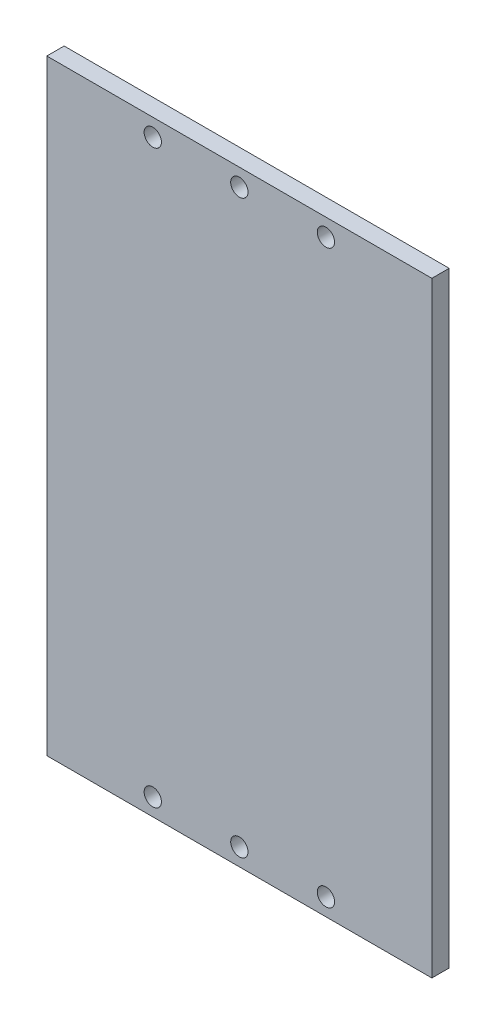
SolidWorks part; units mm, degrees
ref_plane "Front Plane" through (0, 0, 0) normal (0, 0, 1) x (1, 0, 0)
ref_plane "Top Plane" through (0, 0, 0) normal (0, 1, 0) x (1, 0, 0)
ref_plane "Right Plane" through (0, 0, 0) normal (1, 0, 0) x (0, 0, -1)
sketch "Sketch1" plane through (0, 0, 0) normal (0, 0, 1) x (1, 0, 0)
  line L0 (-24.9424, 1) -> (-9.2711, 1)
  line L5 (13.97, 5) -> (13.97, -35) construction
  line L7 (-30.5122, -1) -> (13.97, -1)
  line L8 (-7.2711, 1) -> (8.4003, 1)
  line L9 (-24.9424, -3) -> (-9.2711, -3)
  line L10 (-7.2711, -3) -> (8.4003, -3)
  line L11 (-24.9424, -7) -> (-9.2711, -7)
  line L12 (-7.2711, -7) -> (8.4003, -7)
  line L13 (-24.9424, -11) -> (-9.2711, -11)
  line L14 (-7.2711, -11) -> (8.4003, -11)
  line L15 (-24.9424, -15) -> (-9.2711, -15)
  line L16 (-7.2711, -15) -> (8.4003, -15)
  line L17 (-24.9424, -19) -> (-9.2711, -19)
  line L18 (-7.2711, -19) -> (8.4003, -19)
  line L19 (-24.9424, -23) -> (-9.2711, -23)
  line L20 (-7.2711, -23) -> (8.4003, -23)
  line L21 (-24.9424, -27) -> (-9.2711, -27)
  line L22 (-7.2711, -27) -> (8.4003, -27)
  line L23 (-24.9424, -31) -> (-9.2711, -31)
  line L24 (-7.2711, -31) -> (8.4003, -31)
  line L25 (-24.9424, -35) -> (-9.2711, -35)
  line L26 (-7.2711, -35) -> (8.4003, -35)
  line L27 (-24.9424, -39) -> (-9.2711, -39)
  line L28 (-7.2711, -39) -> (8.4003, -39)
  line L29 (-24.9424, -43) -> (-9.2711, -43)
  line L30 (-7.2711, -43) -> (8.4003, -43)
  line L31 (-24.9424, -47) -> (-9.2711, -47)
  line L32 (-7.2711, -47) -> (8.4003, -47)
  line L33 (-24.9424, -51) -> (-9.2711, -51)
  line L34 (-7.2711, -51) -> (8.4003, -51)
  line L35 (-24.9424, -55) -> (-9.2711, -55)
  line L36 (-7.2711, -55) -> (8.4003, -55)
  line L37 (-30.5122, -5) -> (13.97, -5)
  line L38 (-30.5122, -9) -> (13.97, -9)
  line L39 (-30.5122, -13) -> (13.97, -13)
  line L40 (-30.5122, -17) -> (13.97, -17)
  line L41 (-30.5122, -21) -> (13.97, -21)
  line L42 (-30.5122, -25) -> (13.97, -25)
  line L43 (-30.5122, -29) -> (13.97, -29)
  line L44 (-24.9424, -59) -> (-9.2711, -59)
  line L45 (-7.2711, -59) -> (8.4003, -59)
  line L46 (-30.5122, -33) -> (13.97, -33)
  line L47 (-30.5122, -37) -> (13.97, -37)
  line L48 (-30.5122, -41) -> (13.97, -41)
  line L49 (-30.5122, -45) -> (13.97, -45)
  line L50 (-30.5122, -49) -> (13.97, -49)
  line L51 (-30.5122, -53) -> (13.97, -53)
  line L52 (-30.5122, -57) -> (13.97, -57)
  point P0 (0, 0)
  point P1 (0, 0)
  point P2 (0, 0)
sketch "Croquis1" plane through (0, 0, 0) normal (0, 0, 1) x (1, 0, 0)
  line L0 (-7.2711, 1) -> (8.4003, 1) construction
  line L1 (-30.51, 5) -> (13.97, 5)
  line L2 (-30.51, 5) -> (-30.51, -65)
  line L3 (-30.51, -65) -> (13.97, -65)
  line L4 (13.97, 5) -> (13.97, -65)
  line L5 (13.97, -30) -> (-30.51, -30) construction
  circle A1 centre (-8.27, -63) radius 1
  circle A2 centre (1.73, -63) radius 1
  circle A3 centre (-18.27, -63) radius 1
  circle A7 centre (1.73, 3) radius 1
  circle A8 centre (-8.27, 3) radius 1
  circle A9 centre (-18.27, 3) radius 1
  point P4 (-8.27, 5)
  point P8 (0.5646, 1)
  point P18 (22.24, -15)
  point P19 (-22.24, -15)
  point P27 (-8.2546, 3)
  point P31 (-21.1305, 4.2826)
extrude "Saliente-Extruir2" add sketch "Croquis1" along normal blind 2
equation "\"T\" = 2'Material thickness (mm)"
equation "\"k\"= 0.2'kerf mm"
equation "\"theta\"= 360'Total bend angle DEG"
equation "\"theta_rad\"= 3.14159 * \"theta\" / 180'Total bend angle RAD"
equation "\"n\"= round ( ( \"theta_rad\" / ( 3.14159 / 4 - arccos ( ( \"k\" + \"T\" ) / ( 2 * sqr ( ( \"T\" ^ 2 ) / 2 ) ) ) ) ) / 2 )'Minimum number of columns of torsional links"
equation "\"tallow\"= 20'Torsional Stress Allowed MPA"
equation "\"G\"= 1500'Torsional Modulus of the material (Pa)"
equation "\"l\"= 0.676125 * ( \"theta_rad\" * \"G\" * \"T\" ) / ( \"tallow\" * \"n\" )"
equation "\"D1@Sketch1\"=\"T\""
equation "\"D2@Sketch1\"=\"l\""
equation "\"D3@Sketch1\"=\"l\""
equation "\"D4@Sketch1\"=\"T\""
equation "\"D7@Sketch1\"=\"n\"/2 + 1"
equation "\"D9@Sketch1\"=\"n\"/2"
equation "\"D11@Sketch1\"=\"T\"*2"
equation "\"D10@Sketch1\"=\"T\"*2"
equation "\"distancia_rectangulo\"= 44.48'Ancho del rectangulo"
equation "\"D1@Croquis1\"=\"distancia_rectangulo\""
equation "\"largo_rectangulo\"= \"T\" * \"n\" + 10'altura total del rectangulo"
equation "\"D2@Croquis1\"=\"largo_rectangulo\""
equation "\"D1@Saliente-Extruir2\"=\"T\""
equation "\"D9@Croquis1\"=\"largo_rectangulo\"/2"
